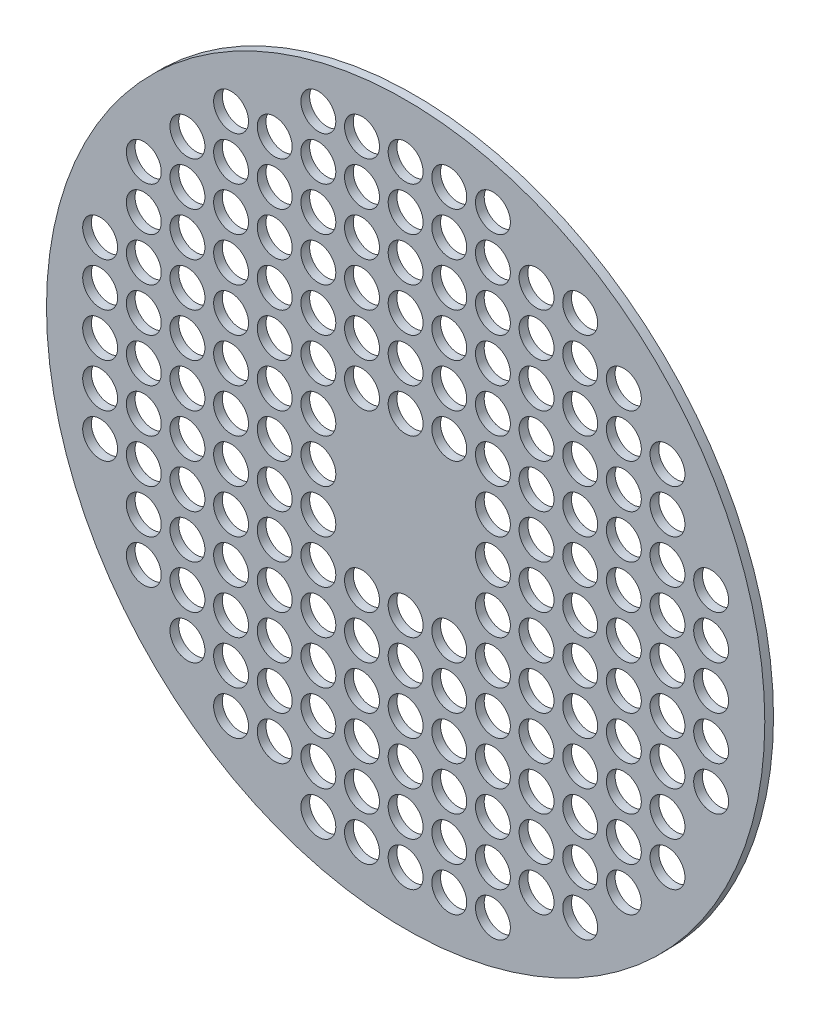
SolidWorks part; units mm, degrees
ref_plane "Front" through (0, 0, 0) normal (0, 0, 1) x (1, 0, 0)
ref_plane "Top" through (0, 0, 0) normal (0, 1, 0) x (1, 0, 0)
ref_plane "Right" through (0, 0, 0) normal (1, 0, 0) x (0, 0, -1)
sketch "Sketch1" plane through (0, 0, 0) normal (0, 0, 1) x (1, 0, 0)
  circle A0 centre (0, 0) radius 10.4521 construction
  circle A1 centre (0, 0) radius 9.8298 construction
  circle A2 centre (0, 0) radius 1.905 construction
  dimension "D1" = 20.9042
  dimension "D2" = 19.6596
  dimension "D3" = 3.81
sketch "Sketch2" plane through (0, 0, 0) normal (0, 0, 1) x (1, 0, 0)
  line L1 (-12.7, 12.7) -> (12.7, 12.7)
  line L2 (-12.7, 12.7) -> (-12.7, -12.7)
  line L3 (-12.7, -12.7) -> (12.7, -12.7)
  line L4 (12.7, 12.7) -> (12.7, -12.7)
  point P4 (12.7, 0)
  point P5 (0, -12.7)
  dimension "D1" = 25.4
extrude "Extrude1" add sketch "Sketch2" along normal blind 0.254
sketch "Sketch3" plane through (0, 0, 0) normal (0, 0, 1) x (1, 0, 0)
  circle A0 centre (0, 0) radius 0.508
  dimension "D1" = 1.016
extrude "Cut-Extrude2" cut sketch "Sketch3" along normal through all
pattern_linear "LPattern1" count 8 spacing 1.27 along (0, 1, 0) count 8 spacing 1.27 along (-1, 0, 0) of "Cut-Extrude2"
mirror "Mirror1" about plane through (0, 0, 0) normal (0, 1, 0) of "LPattern1"
mirror "Mirror2" about plane through (0, 0, 0) normal (1, 0, 0) of "Mirror1", "LPattern1"
sketch "Sketch4" plane through (0, 0, 0) normal (0, 0, 1) x (1, 0, 0)
  circle A0 centre (0, 0) radius 10.4521
  circle A1 centre (0, 0) radius 10.4521 construction
extrude "Cut-Extrude4" cut sketch "Sketch4" along normal through all flip side to cut
sketch "Sketch5" plane through (0, 0, 0) normal (0, 0, 1) x (1, 0, 0)
  circle A0 centre (0, 0) radius 9.8298
  circle A2 centre (0, 0) radius 10.4521
  circle A4 centre (0, 0) radius 10.4521 construction
  circle A5 centre (0, 0) radius 9.8298 construction
extrude "Extrude2" add sketch "Sketch5" along normal blind 0.127
sketch "Sketch6" plane through (0, 0, 0) normal (0, 0, 1) x (1, 0, 0)
  circle A0 centre (0, 0) radius 1.905
  circle A1 centre (0, 0) radius 1.905 construction
extrude "Extrude4" add sketch "Sketch6" along normal up to surface (0.254 mm away)
